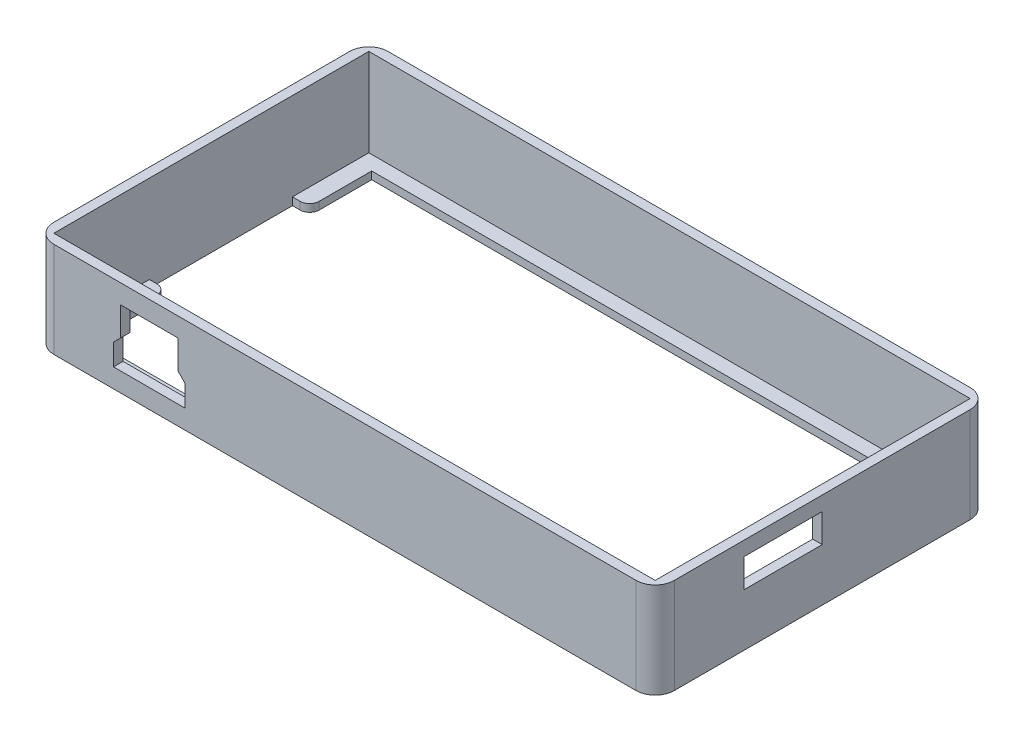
SolidWorks part; units mm, degrees
ref_plane "前视基准面" through (0, 0, 0) normal (0, 0, 1) x (1, 0, 0)
ref_plane "上视基准面" through (0, 0, 0) normal (0, 1, 0) x (1, 0, 0)
ref_plane "右视基准面" through (0, 0, 0) normal (1, 0, 0) x (0, 0, -1)
sketch "草图1" plane through (0, 0, 0) normal (0, 1, 0) x (1, 0, 0)
  line L1 (-32.5, -17.5) -> (32.5, -17.5)
  line L2 (-32.5, -17.5) -> (-32.5, 17.5)
  line L3 (-32.5, 17.5) -> (32.5, 17.5)
  line L4 (32.5, -17.5) -> (32.5, 17.5)
  line L5 (-32.5, -17.5) -> (32.5, 17.5) construction
  line L6 (-32.5, 17.5) -> (32.5, -17.5) construction
  point P0 (0, 0)
  dimension "D1" = 65
  dimension "D2" = 35
extrude "凸台-拉伸1" add sketch "草图1" along normal blind 10
sketch "草图3" plane through (0, 0, 0) normal (0, -1, 0) x (1, 0, 0)
  line L0 (-32.5, 17.5) -> (32.5, 17.5) construction
  line L1 (-29.7, -15) -> (30.5, -15)
  line L2 (32.5, -17.5) -> (-32.5, -17.5) construction
  line L3 (32.5, 17.5) -> (32.5, -17.5) construction
  line L4 (30.5, -15) -> (30.5, 15)
  line L5 (30.5, 15) -> (-29.7, 15)
  line L6 (-31.5, 6.5) -> (-29.7, 6.5)
  line L7 (-31.5, 6.5) -> (-31.5, -8.5)
  line L9 (-31.5, -8.5) -> (-29.7, -8.5)
  line L10 (-29.7, 6.5) -> (-29.7, 15)
  line L11 (-29.7, -8.5) -> (-29.7, -15)
  line L12 (-32.5, -17.5) -> (-32.5, 17.5) construction
  dimension "D1" = 8.5
  dimension "D2" = 6.5
  dimension "D3" = 2.8
  dimension "D4" = 2.8
  dimension "D5" = 2.5
  dimension "D6" = 2.5
  dimension "D7" = 2
  dimension "D8" = 1
shell "抽壳4" thickness 1
extrude "切除-拉伸4" cut sketch "草图3" against normal up to next
ref_plane "基准面1" through (0, 5, 0) normal (0, 1, 0) x (1, 0, 0)
fillet "圆角2" radius 2 4 edges at (32.5, 5, -17.5) (32.5, 5, 17.5) (-32.5, 5, -17.5) (-32.5, 5, 17.5)
fillet "圆角3" radius 1 2 edges at (-29.7, 0.4, 6.5) (-29.7, 0.4, -8.5)
ref_plane "基准面2" through (-32.5, 10, 15.5) normal (0, 0, 1) x (1, 0, 0)
sketch "草图11" plane through (32.5, 0, 0) normal (1, 0, 0) x (0, 0, -1)
  line L0 (-15.5, 5.5) -> (15.5, 5.5) construction
  line L1 (-15.5, 10) -> (-15.5, 0) construction
  line L2 (15.5, 0) -> (15.5, 10) construction
  line L3 (-15.5, 0) -> (15.5, 0) construction
  line L4 (-15.5, 8.5) -> (15.5, 8.5) construction
  line L5 (-8.2, 10) -> (-8.2, 0) construction
  line L6 (-15.5, 10) -> (15.5, 10) construction
  line L7 (0.8, 10) -> (0.8, 0) construction
  line L8 (0, 5.5) -> (0, 8.5)
  line L9 (0, 8.5) -> (-8.2, 8.5)
  line L10 (-8.2, 8.5) -> (-8.2, 5.5)
  line L11 (-8.2, 5.5) -> (0, 5.5)
  dimension "D1" = 5.5
  dimension "D2" = 3
  dimension "D3" = 7.3
  dimension "D4" = 9
extrude "切除-拉伸5" cut sketch "草图11" against normal up to next
sketch "草图12" plane through (0, 0, 17.5) normal (0, 0, 1) x (1, 0, 0)
  line L0 (-20.5, 4.5) -> (-20.5, 5) construction
  line L1 (19.25, 5) -> (-19.25, 5) construction
  line L2 (-23.5, 5) -> (-24.25, 4.25)
  line L3 (-23.5, 8) -> (-17.5, 8)
  line L4 (-23.5, 8) -> (-23.5, 5)
  line L5 (-23.5, 2) -> (-17.5, 2)
  line L6 (-17.5, 8) -> (-17.5, 5)
  line L7 (-23.5, 8) -> (-17.5, 2) construction
  line L8 (-23.5, 2) -> (-17.5, 8) construction
  line L9 (-24.25, 4.25) -> (-24.25, 2)
  line L10 (-24.25, 2) -> (-23.5, 2)
  line L11 (-17.5, 5) -> (-16.75, 4.25)
  line L12 (-16.75, 4.25) -> (-16.75, 2)
  line L13 (-16.75, 2) -> (-17.5, 2)
  circle A0 centre (-20.5, 5) radius 1.9 construction
  dimension "D1" = 3.8
  dimension "D2" = 6
  dimension "D3" = 6
  dimension "D4" = 0.75
  dimension "D5" = 0.75
  dimension "D6" = 45
extrude "切除-拉伸6" cut sketch "草图12" against normal blind 3
